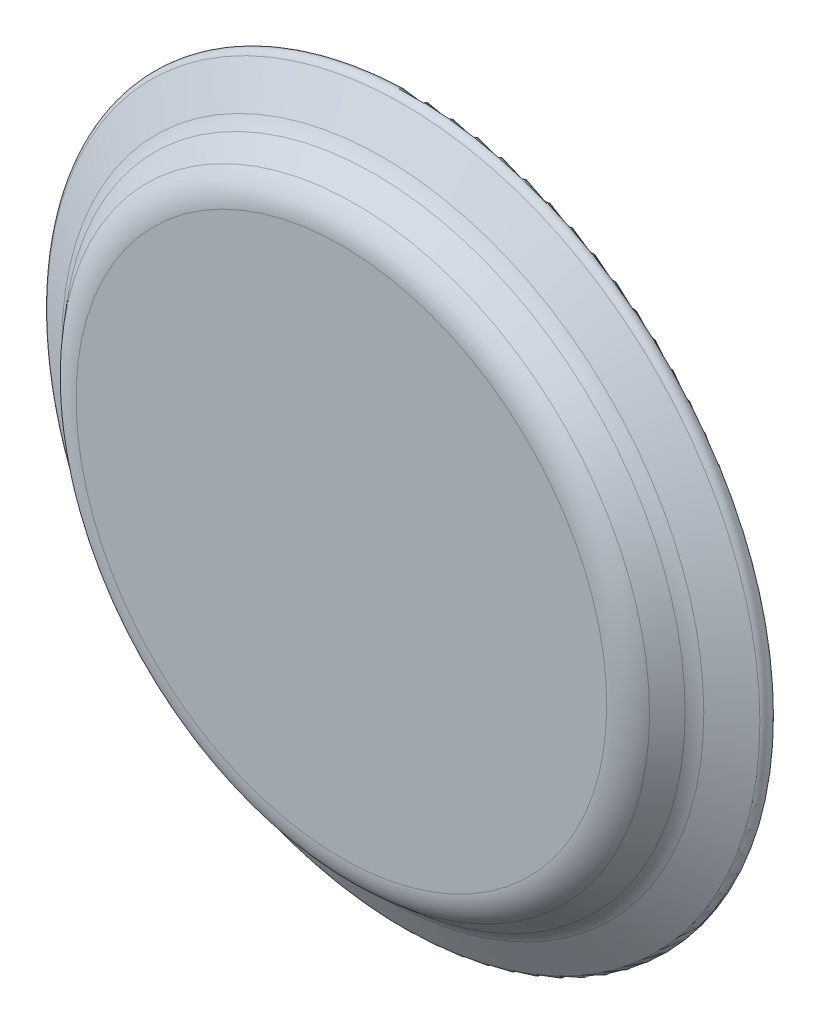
SolidWorks part; units mm, degrees
ref_plane "Front Plane" through (0, 0, 0) normal (0, 0, 1) x (1, 0, 0)
ref_plane "Top Plane" through (0, 0, 0) normal (0, 1, 0) x (1, 0, 0)
ref_plane "Right Plane" through (0, 0, 0) normal (1, 0, 0) x (0, 0, -1)
sketch "Sketch1" plane through (0, 0, 0) normal (0, 0, 1) x (1, 0, 0)
  circle A0 centre (0, 0) radius 100
  dimension "D1" = 200
extrude "Boss-Extrude1" add sketch "Sketch1" along normal blind 10 draft 60 contours A0
sketch "Sketch2" plane through (0, 0, 10) normal (0, 0, 1) x (1, 0, 0)
  circle A0 centre (0, 0) radius 82.6795
extrude "Boss-Extrude2" add sketch "Sketch2" along normal blind 10 draft 40
fillet "Fillet1" radius 10 2 edges at (82.6795, 0, 10) (74.2885, 0, 20)
fillet "Fillet2" radius 2 1 edges at (100, 0, 0)
shell "Shell2" thickness 5
